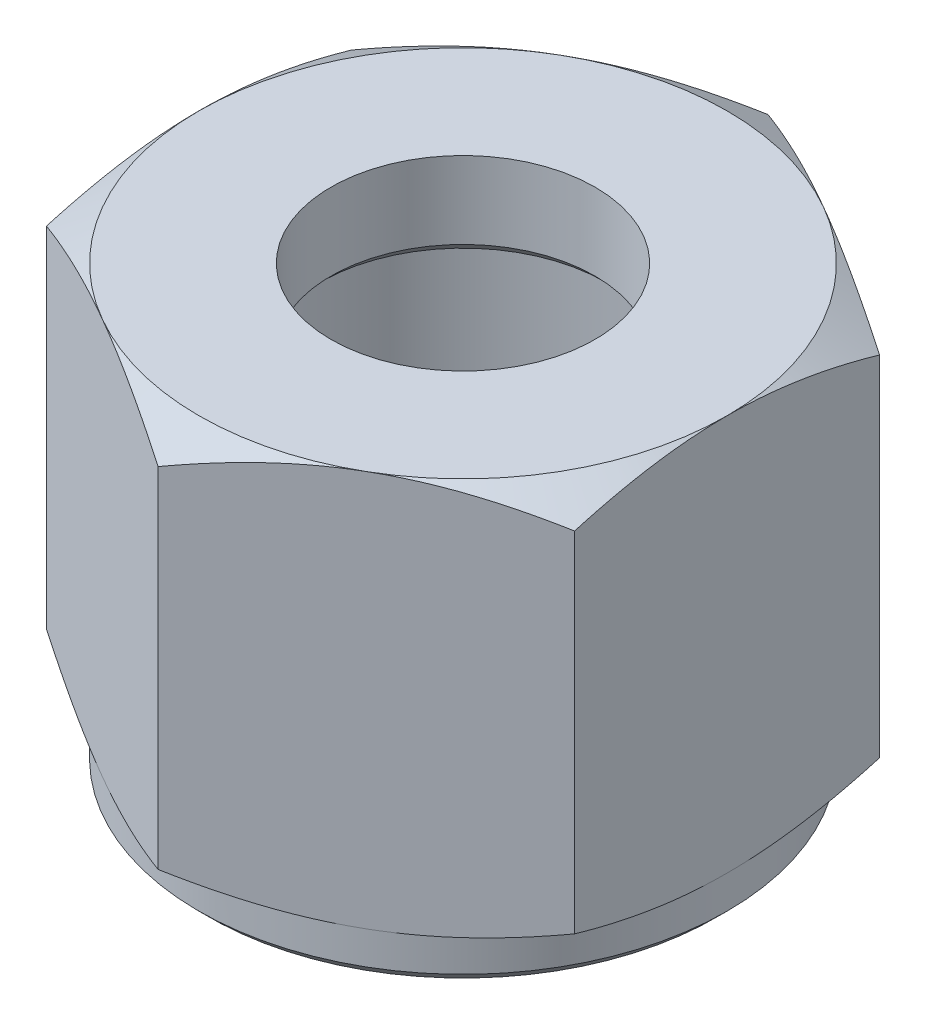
SolidWorks part; units mm, degrees
ref_plane "Přední rovina" through (0, 0, 0) normal (0, 0, 1) x (1, 0, 0)
ref_plane "Horní rovina" through (0, 0, 0) normal (0, 1, 0) x (1, 0, 0)
ref_plane "Pravá rovina" through (0, 0, 0) normal (1, 0, 0) x (0, 0, -1)
sketch "Skica1" plane through (0, 0, 0) normal (0, 1, 0) x (1, 0, 0)
  line L1 (0, 13.8564) -> (-12, 6.9282)
  line L2 (-12, 6.9282) -> (-12, -6.9282)
  line L3 (-12, -6.9282) -> (0, -13.8564)
  line L4 (0, -13.8564) -> (12, -6.9282)
  line L5 (12, -6.9282) -> (12, 6.9282)
  line L6 (12, 6.9282) -> (0, 13.8564)
  circle A0 centre (0, 0) radius 12 construction
extrude "Přidat vysunutím1" add sketch "Skica1" along normal blind 18
sketch "Skica2" plane through (0, 18, 0) normal (0, 1, 0) x (-1, 0, 0)
  circle A0 centre (0, 0) radius 12
extrude "Odebrat vysunutím1" cut sketch "Skica2" against normal blind 18 draft 60 flip side to cut
sketch "Skica3" plane through (0, 0, 0) normal (0, -1, 0) x (1, 0, 0)
  circle A0 centre (0, 0) radius 12
extrude "Odebrat vysunutím2" cut sketch "Skica3" against normal blind 18 draft 60 flip side to cut
sketch "Skica4" plane through (0, 0, 0) normal (0, -1, 0) x (1, 0, 0)
  circle A0 centre (0, 0) radius 12
extrude "Přidat vysunutím2" add sketch "Skica4" along normal blind 2
chamfer "Zkosení1" distance 0.5 angle 45 1 edges at (0, -2, -12)
sketch "Skica5" plane through (0, -2, 0) normal (0, -1, 0) x (1, 0, 0)
  circle A0 centre (0, 0) radius 9
extrude "Odebrat vysunutím3" cut sketch "Skica5" against normal blind 16
chamfer "Zkosení2" distance 0.35 angle 45 1 edges at (0, -2, -9)
sketch "Skica6" plane through (0, 18, 0) normal (0, 1, 0) x (1, 0, 0)
  circle A0 centre (0, 0) radius 6
extrude "Odebrat vysunutím4" cut sketch "Skica6" against normal up to surface (4 mm away)
chamfer "Zkosení3" distance 0.5 angle 45 1 edges at (0, 14, -6)
